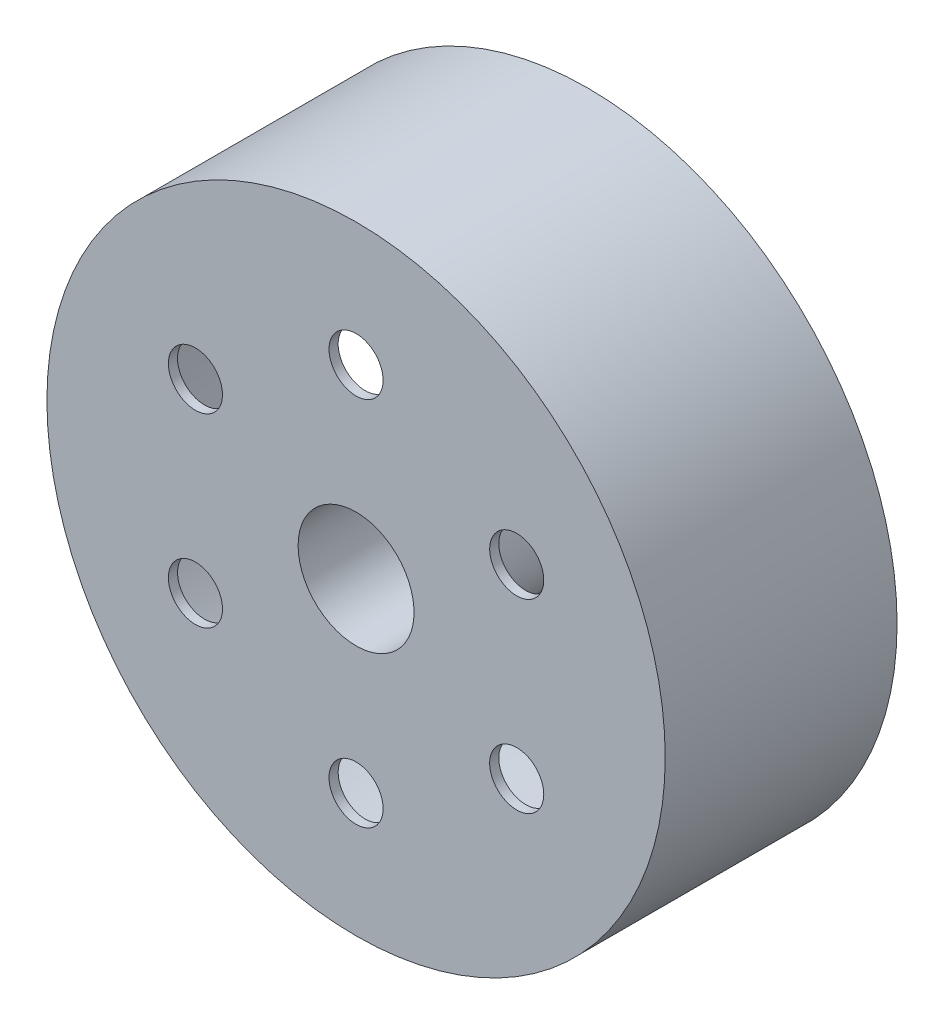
SolidWorks part; units mm, degrees
ref_plane "Front Plane" through (0, 0, 0) normal (0, 0, 1) x (1, 0, 0)
ref_plane "Top Plane" through (0, 0, 0) normal (0, 1, 0) x (1, 0, 0)
ref_plane "Right Plane" through (0, 0, 0) normal (1, 0, 0) x (0, 0, -1)
sketch "Sketch1" plane through (0, 0, 0) normal (0, 0, 1) x (1, 0, 0)
  circle A0 centre (0, 0) radius 101.6
  circle A1 centre (0, 0) radius 19.05
  dimension "D1" = 203.2
  dimension "D2" = 38.1
extrude "Boss-Extrude1" add sketch "Sketch1" along normal blind 76.2
sketch "Sketch3" plane through (0, 0, 0) normal (0, 0, -1) x (-1, 0, 0)
  circle A2 centre (0, 0) radius 96.52
  circle A3 centre (0, 0) radius 96.52
  circle A5 centre (0, 0) radius 24.13
  circle A6 centre (0, 0) radius 24.13
  dimension "D1" = 5.08
  dimension "D2" = 5.08
extrude "Cut-Extrude1" cut sketch "Sketch3" against normal offset from surface (73.2 mm away) 3
sketch "Sketch4" plane through (0, 0, 76.2) normal (0, 0, 1) x (1, 0, 0)
  circle A0 centre (0, 60.96) radius 8.89
  dimension "D1" = 60.96
extrude "Cut-Extrude2" cut sketch "Sketch4" against normal blind 17.78
pattern_circular "CirPattern1" count 6 over 360 about axis through (0, 0, 0) along (0, 0, 1) of "Cut-Extrude2"
